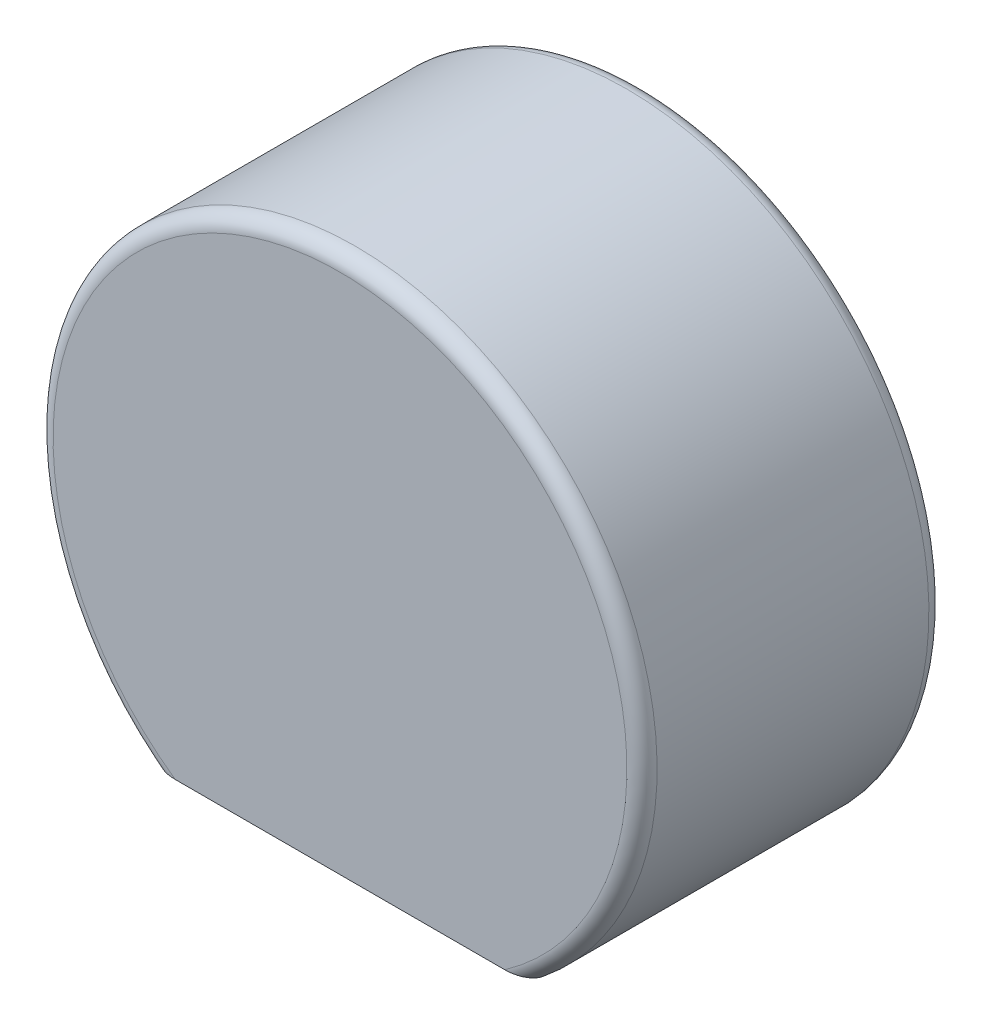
SolidWorks part; units mm, degrees
ref_plane "Front Plane" through (0, 0, 0) normal (0, 0, 1) x (1, 0, 0)
ref_plane "Top Plane" through (0, 0, 0) normal (0, 1, 0) x (1, 0, 0)
ref_plane "Right Plane" through (0, 0, 0) normal (1, 0, 0) x (0, 0, -1)
sketch "Sketch1" plane through (0, 0, 0) normal (0, 0, 1) x (1, 0, 0)
  line L1 (-12.5708, -15.5556) -> (12.5708, -15.5556)
  arc A0 (12.5708, -15.5556) -> (-12.5708, -15.5556) centre (0, 0) ccw
extrude "Boss-Extrude1" add sketch "Sketch1" along normal blind 20
fillet "Fillet1" radius 1 2 edges at (0, 20, 0) (0, 20, 20)
